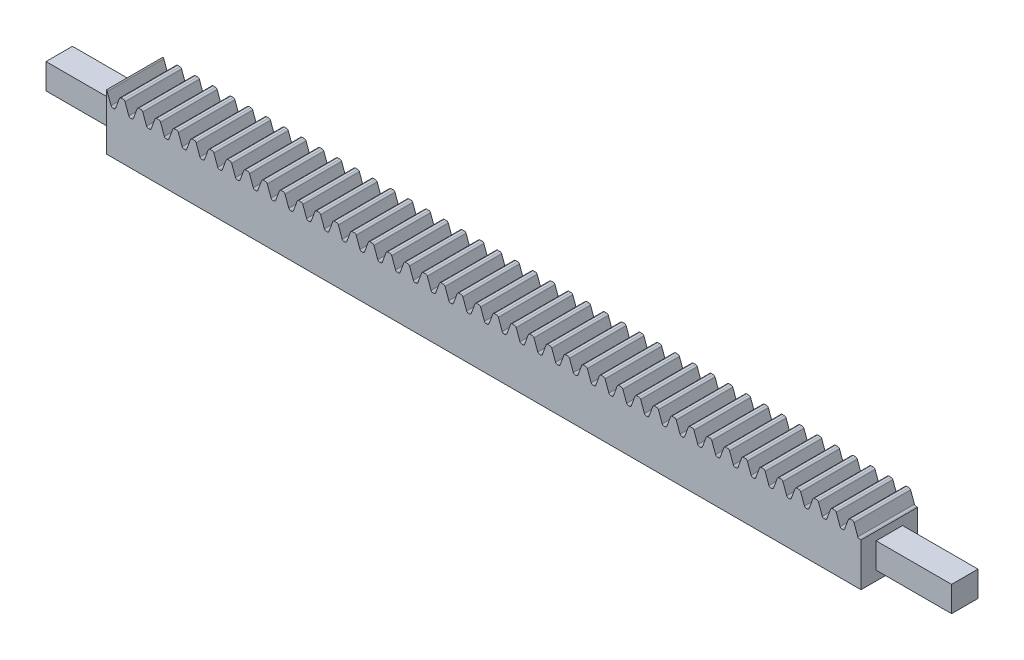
SolidWorks part; units mm, degrees
ref_plane "Front Plane" through (0, 0, 0) normal (0, 0, 1) x (1, 0, 0)
ref_plane "Top Plane" through (0, 0, 0) normal (0, 1, 0) x (1, 0, 0)
ref_plane "Right Plane" through (0, 0, 0) normal (1, 0, 0) x (0, 0, -1)
sketch "Sketch1" plane through (0, 0, 0) normal (0, 0, 1) x (1, 0, 0)
  line L0 (-250, 7.4) -> (-250, -7.4) construction
  line L1 (-250, -7.4) -> (250, -7.4) construction
  line L2 (250, -7.4) -> (250, 7.4) construction
  line L4 (0, 7.4) -> (0, -7.4) construction
  line L5 (-250, 5.9) -> (250, 5.9) construction
  line L6 (-248.0326, 7.4) -> (-246.7683, 7.4) construction
  line L7 (-246.7683, 7.4) -> (-245.5399, 4.025) construction
  line L8 (-248.0326, 7.4) -> (-249.261, 4.025) construction
  line L9 (-249.261, 4.025) -> (-245.5399, 4.025) construction
  line L10 (-247.4004, 7.4) -> (-247.4004, 4.025) construction
  line L11 (-250, 0) -> (-237.9756, 0) construction
  line L12 (250, 0) -> (237.9756, 0) construction
  point P15 (-242.688, 7.4)
  point P16 (-53, -7.4)
  point P17 (-246.2223, 5.9)
  point P18 (-248.5785, 5.9)
  point P21 (-0.75, -7.4)
sketch "Sketch2" plane through (0, 0, 0) normal (1, 0, 0) x (0, 0, -1)
  line L0 (-7.5, 0) -> (7.5, 0) construction
  dimension "Face Width" = 15
sketch "Sketch3" plane through (0, 0, 0) normal (0, 0, 1) x (1, 0, 0)
  line L1 (-250, 7.4) -> (250, 7.4)
  line L2 (-250, 7.4) -> (-250, -7.4)
  line L3 (-250, -7.4) -> (250, -7.4)
  line L4 (250, 7.4) -> (250, -7.4)
extrude "Boss-Extrude1" add sketch "Sketch3" against normal up to vertex and the other way up to vertex
sketch "Sketch4" plane through (0, 0, 0) normal (0, 0, 1) x (1, 0, 0)
  line L0 (-247.4004, 7.4) -> (-242.688, 7.4) construction
  line L9 (-245.0442, 7.4) -> (-245.0442, 4.025)
  line L10 (-245.0442, 4.025) -> (-245.5399, 4.025)
  line L11 (-245.5399, 4.025) -> (-246.7683, 7.4)
  line L12 (-246.7683, 7.4) -> (-245.0442, 7.4)
  line L13 (-248.0326, 7.4) -> (-249.261, 4.025)
  line L14 (-249.261, 4.025) -> (-249.7566, 4.025)
  line L15 (-249.7566, 4.025) -> (-249.7566, 7.4)
  line L16 (-249.7566, 7.4) -> (-248.0326, 7.4)
  line L17 (250, 7.4) -> (-250, 7.4) construction
  line L18 (-248.0326, 7.4) -> (-247.6802, 7.4)
  line L19 (-247.1207, 7.4) -> (-246.7683, 7.4)
  arc A0 (-249.6133, 4.025) -> (-249.1404, 4.3561) centre (-249.6133, 4.5283) ccw
  arc A1 (-245.6604, 4.3561) -> (-245.1875, 4.025) centre (-245.1875, 4.5283) ccw
  arc A2 (-248.1531, 7.0689) -> (-247.6802, 7.4) centre (-247.6802, 6.8967) cw
  arc A3 (-247.1207, 7.4) -> (-246.6478, 7.0689) centre (-247.1207, 6.8967) cw
extrude "Cut-Extrude1" cut sketch "Sketch4" against normal through all both and the other way through all contours L14 A0 L13 L16 L15 | L13 A2 L18 | L19 A3 L11 | L11 A1 L10 L9 L12
pattern_linear "LPattern1" count 107 spacing 4.7124 along (1, 0, 0) count 2 spacing 4.7124 along (-1, 0, 0) of "Cut-Extrude1"
sketch "Drawing Refernce 1" plane through (0, 0, 7.5) normal (0, 0, 1) x (1, 0, 0)
  line L0 (-250, 0) -> (250, 0) construction
  point P6 (-235, 0)
  point P7 (-227.5, 0)
  point P8 (235, 0)
sketch "Sketch5" plane through (0, 0, 7.5) normal (0, 0, 1) x (1, 0, 0)
  line L0 (-250, -7.4) -> (-250, 10.7263)
  line L2 (-250, 10.7263) -> (-150, 10.7263)
  line L3 (-150, 10.7263) -> (-150, -7.4)
  line L4 (-250, -7.4) -> (-150, -7.4)
  dimension "D1" = 100
extrude "Cut-Extrude2" cut sketch "Sketch5" against normal blind 2500
sketch "Sketch6" plane through (0, 0, 7.5) normal (0, 0, 1) x (1, 0, 0)
  line L0 (-150, -7.4) -> (-150, 14.2227)
  line L1 (-150, 14.2227) -> (50, 14.2227)
  line L2 (50, 14.2227) -> (50, -13.307)
  line L3 (50, -13.307) -> (-150, -13.307)
  line L4 (-150, -13.307) -> (-150, -7.4)
  dimension "D1" = 200
extrude "Cut-Extrude3" cut sketch "Sketch6" against normal blind 30
sketch "Sketch7" plane through (50, 0, 0) normal (-1, 0, 0) x (0, 0, 1)
  line L11 (-7.5, -7.4) -> (7.5, -7.4) construction
  line L18 (-3.5, -4.9) -> (3.5, -4.9)
  line L19 (3.5, -4.9) -> (3.5, 1.839)
  line L20 (3.5, 1.839) -> (-3.5, 1.839)
  line L21 (-3.5, 1.839) -> (-3.5, -4.9)
  dimension "D1" = 2.5
extrude "Boss-Extrude2" add sketch "Sketch7" along normal blind 20
sketch "Sketch8" plane through (250, 0, 0) normal (1, 0, 0) x (0, 0, -1)
  line L0 (7.5, -7.4) -> (-7.5, -7.4) construction
  line L1 (-3.5, 1.84) -> (3.5, 1.84)
  line L2 (-3.5, 1.84) -> (-3.5, -4.9)
  line L3 (-3.5, -4.9) -> (3.5, -4.9)
  line L4 (3.5, 1.84) -> (3.5, -4.9)
  line L5 (7.5, -7.4) -> (7.5, 4.0351) construction
  dimension "D1" = 7
  dimension "D2" = 6.74
  dimension "D3" = 2.5
  dimension "D4" = 4
extrude "Boss-Extrude3" add sketch "Sketch8" along normal blind 20
equation "\"Diametral Pitch\"= 1 / \"Module\""
equation "\"Pressure Angle\"=20"
equation "\"Dedendum\"= 1.25 / \"Diametral Pitch\""
equation "\"Addendum\"= 1 / \"Diametral Pitch\""
equation "\"WorkingDepth\"= 2 / \"Diametral Pitch\""
equation "\"WholeDepth\"= 2.25 / \"Diametral Pitch\""
equation "\"Clearance\"= 0.25 / \"Diametral Pitch\""
equation "\"ToothThickness\"= ( pi / 2 ) / \"Diametral Pitch\""
equation "\"CircularPitch\"= pi / \"Diametral Pitch\""
equation "\"Fillet\"= \"Clearance\" * cos ( \"Pressure Angle\" ) * tan ( ( 90 + \"Pressure Angle\" ) / 2 )"
equation "\"Module\"= 1.5"
equation "\"Addendum@Sketch1\"=\"Addendum\""
equation "\"Pressure Angle@Sketch1\"=\"Pressure Angle\""
equation "\"Dedendum@Sketch1\"=\"Dedendum\""
equation "\"Circular Pitch@Sketch1\"=\"CircularPitch\""
equation "\"Circular Tooth Thickness@Sketch1\"=\"ToothThickness\""
equation "\"Module@Sketch1\"=\"Module\""
equation "\"Approximate Number of Teeth@Sketch1\" = int ( \"Length@Sketch1\" /  ( 2 * \"Circular Tooth Thickness@Sketch1\" )  ) "
equation "\"Rack Length@Sketch1\" = \"Circular Pitch@Sketch1\" *  ( \"Approximate Number of Teeth@Sketch1\" - 1 ) "
equation "\"D3@LPattern1\"=\"CircularPitch\""
equation "\"D1@LPattern1\"=\"Approximate Number of Teeth@Sketch1\"+1"
equation "\"D1@Sketch1\"=\"Circular Pitch@Sketch1\"*2"
equation "\"D1@Sketch4\"=\"Fillet\""
equation "\"D4@LPattern1\"=\"CircularPitch\""
equation "\"D2@Drawing Refernce 1\"=\"D1@Drawing Refernce 1\"*1.5"
equation "\"D3@Drawing Refernce 1\"=\"D1@Drawing Refernce 1\""
